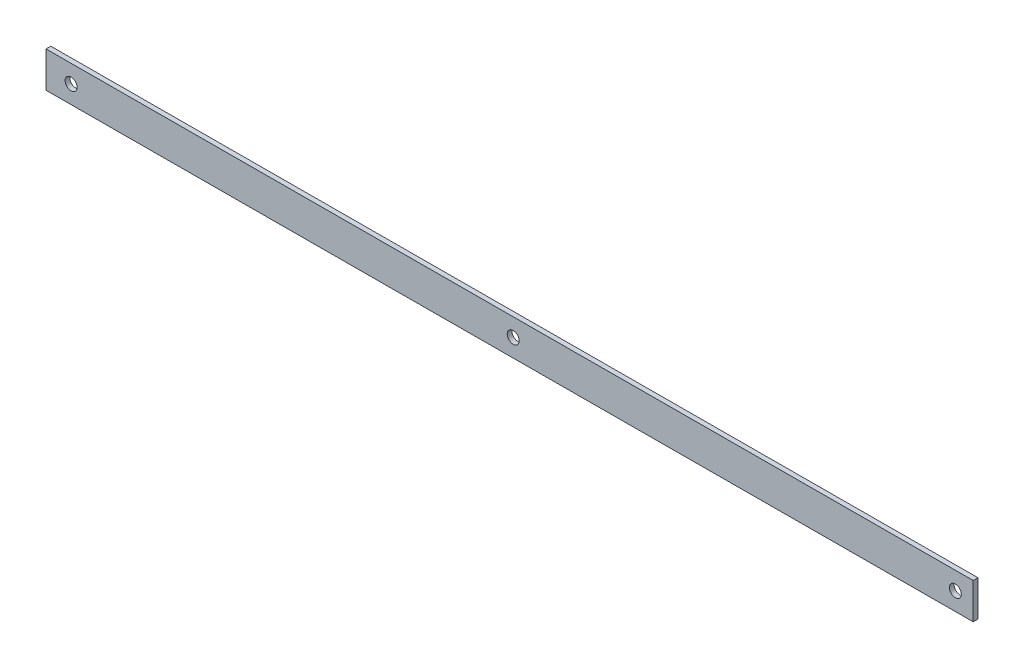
SolidWorks part; units mm, degrees
ref_plane "Plan de face" through (0, 0, 0) normal (0, 0, 1) x (1, 0, 0)
ref_plane "Plan de dessus" through (0, 0, 0) normal (0, 1, 0) x (1, 0, 0)
ref_plane "Plan de droite" through (0, 0, 0) normal (1, 0, 0) x (0, 0, -1)
sketch "Esquisse2" plane through (0, 0, 0) normal (0, 0, 1) x (1, 0, 0)
  line L1 (-485.0794, -4.7524) -> (291.9158, -2.0141)
  line L2 (-485.0794, -4.7524) -> (-485.0794, -34.7526)
  line L3 (-485.0794, -34.7526) -> (291.9158, -32.0143)
  line L4 (291.9158, -2.0141) -> (291.9158, -32.0143)
  circle A3 centre (-464.0796, -19.6785) radius 5
  circle A4 centre (-93.5819, -18.3728) radius 5
  circle A5 centre (276.9158, -17.0671) radius 5
  dimension "D1" = 10
  dimension "D2" = 10
  dimension "D6" = 10
  dimension "D3" = 15
  dimension "D4" = 30
  dimension "D5" = 777
  dimension "D7" = 15
  dimension "D8" = 15
extrude "Extrusion1" add sketch "Esquisse2" along normal blind 4
